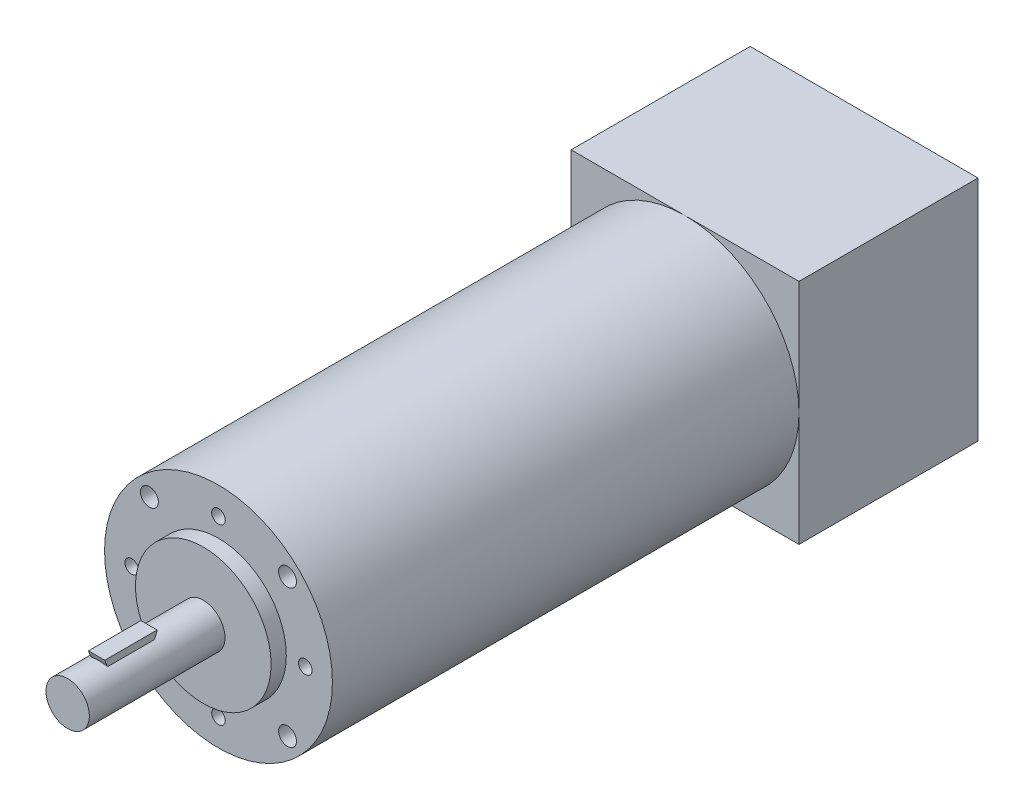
SolidWorks part; units mm, degrees
ref_plane "Face" through (0, 0, 0) normal (0, 0, 1) x (1, 0, 0)
ref_plane "Dessus" through (0, 0, 0) normal (0, 1, 0) x (1, 0, 0)
ref_plane "Droite" through (0, 0, 0) normal (1, 0, 0) x (0, 0, -1)
sketch "Esquisse1" plane through (0, 0, 0) normal (0, 0, 1) x (1, 0, 0)
  circle A0 centre (0, 0) radius 21
  dimension "D1" = 42
extrude "Extrusion1" add sketch "Esquisse1" along normal mid plane 86
sketch "Esquisse2" plane through (0, 0, -43) normal (0, 0, -1) x (-1, 0, 0)
  line L1 (-21, -21) -> (21, -21)
  line L2 (-21, -21) -> (-21, 21)
  line L3 (-21, 21) -> (21, 21)
  line L4 (21, -21) -> (21, 21)
  circle A0 centre (0, 0) radius 21 construction
extrude "Extrusion2" add sketch "Esquisse2" along normal blind 33
sketch "Esquisse3" plane through (0, 0, 43) normal (0, 0, 1) x (1, 0, 0)
  circle A0 centre (0, 0) radius 12.5
  dimension "D1" = 25
extrude "Extrusion3" add sketch "Esquisse3" along normal blind 2.8
sketch "Esquisse4" plane through (0, 0, 45.8) normal (0, 0, 1) x (1, 0, 0)
  circle A0 centre (0, 0) radius 4
  dimension "D1" = 8
extrude "Extrusion4" add sketch "Esquisse4" along normal blind 25
sketch "Esquisse5" plane through (0, 0, 0) normal (1, 0, 0) x (0, 0, -1)
  line L0 (-65.46, 5) -> (-55.8, 5)
  line L2 (-45.8, 12.5) -> (-45.8, -12.5) construction
  arc A0 (-65.46, 5) -> (-55.8, 5) centre (-60.63, 6.3026) ccw
  dimension "D1" = 1.3
  dimension "D2" = 9.66
  dimension "D3" = 3.7
  dimension "D4" = 10
extrude "Extrusion5" add sketch "Esquisse5" along normal mid plane 3
hole_wizard "Trou taraudé M3x0.51" positions "Esquisse8" profile "Esquisse7" tap size "M3x0.5" standard "Ansi Métrique"
sketch "Esquisse8" plane through (0, 0, 43) normal (0, 0, 1) x (1, 0, 0)
  line L1 (0, 16) -> (16, 0) construction
  line L2 (0, 16) -> (-16, 0) construction
  line L3 (-16, 0) -> (0, -16) construction
  line L4 (16, 0) -> (0, -16) construction
  circle A0 centre (0, 0) radius 16 construction
  point P0 (16, 0)
  point P1 (0, 16)
  point P2 (-16, 0)
  point P3 (0, -16)
  dimension "D1" = 32
sketch "Esquisse7" plane through (16, 0, 43) normal (1, 0, 0) x (0, -1, 0)
  line L0 (0, 0) -> (0, 9.7511)
  line L1 (0, 9.7511) -> (1.25, 9)
  line L2 (1.25, 9) -> (1.25, 0)
  line L5 (1.25, 0) -> (0, 0)
  line L10 (0, 9.7511) -> (-1.25, 9) construction
  line L11 (0, -6.35) -> (0, 107.95) construction
  dimension "Diamètre du trou pour taraudage" = 2.5
  dimension "Profondeur du trou pour taraudage" = 9
  dimension "Angle de pointe" = 118
hole_wizard "Trou taraudé M4x0.71" positions "Esquisse11" profile "Esquisse10" tap size "M4x0.7" standard "Ansi Métrique"
sketch "Esquisse11" plane through (0, 0, 43) normal (0, 0, 1) x (1, 0, 0)
  line L1 (-12.7279, -12.7279) -> (12.7279, -12.7279) construction
  line L2 (-12.7279, -12.7279) -> (-12.7279, 12.7279) construction
  line L3 (-12.7279, 12.7279) -> (12.7279, 12.7279) construction
  line L4 (12.7279, -12.7279) -> (12.7279, 12.7279) construction
  circle A0 centre (0, 0) radius 18 construction
  point P0 (-12.7279, -12.7279)
  point P1 (12.7279, 12.7279)
  point P2 (-12.7279, 12.7279)
  point P3 (12.7279, -12.7279)
  dimension "D1" = 36
sketch "Esquisse10" plane through (-12.7279, -12.7279, 43) normal (1, 0, 0) x (0, -1, 0)
  line L0 (0, 0) -> (0, 9.9914)
  line L1 (0, 9.9914) -> (1.65, 9)
  line L2 (1.65, 9) -> (1.65, 0)
  line L5 (1.65, 0) -> (0, 0)
  line L10 (0, 9.9914) -> (-1.65, 9) construction
  line L11 (0, -6.35) -> (0, 107.95) construction
  dimension "Diamètre du trou pour taraudage" = 3.3
  dimension "Profondeur du trou pour taraudage" = 9
  dimension "Angle de pointe" = 118
